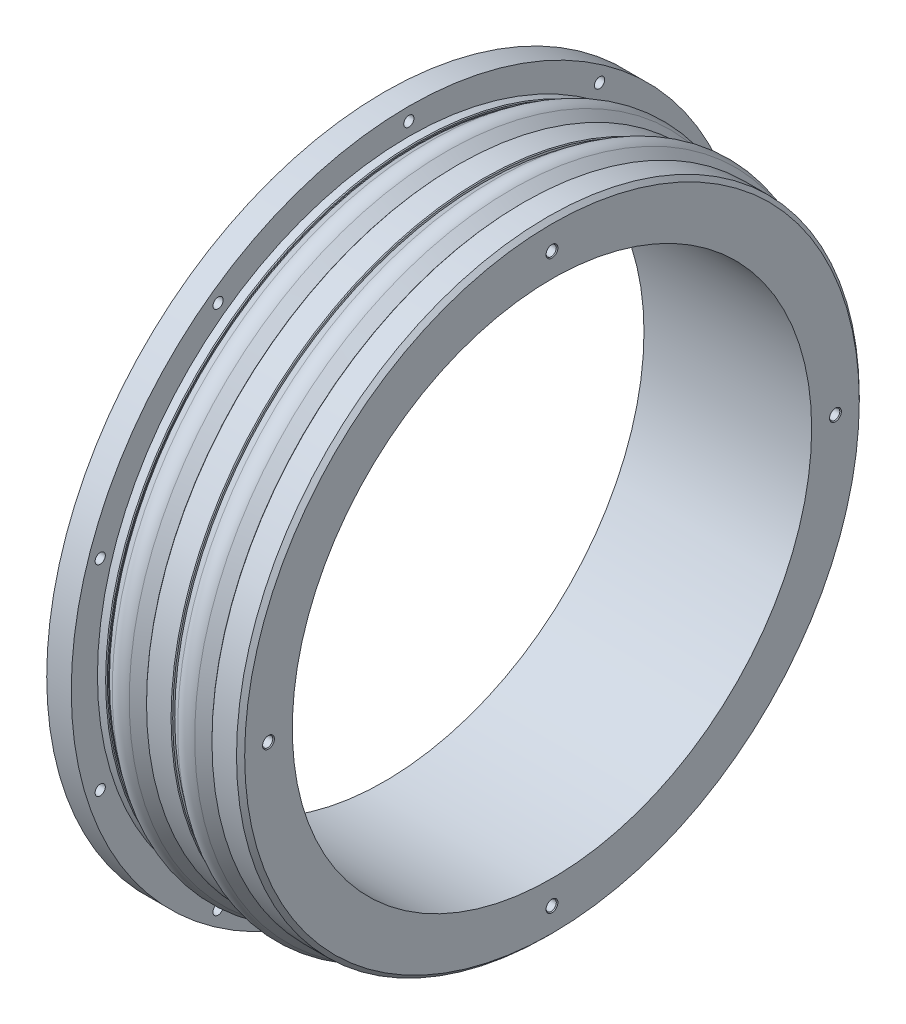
SolidWorks part; units mm, degrees
ref_plane "Front Plane" through (0, 0, 0) normal (0, 0, 1) x (1, 0, 0)
ref_plane "Top Plane" through (0, 0, 0) normal (0, 1, 0) x (1, 0, 0)
ref_plane "Right Plane" through (0, 0, 0) normal (1, 0, 0) x (0, 0, -1)
sketch "Sketch2" plane through (0, 0, 0) normal (0, 1, 0) x (1, 0, 0)
  line L0 (0, 0) -> (0, 63.5) construction
  line L1 (0, 63.5) -> (41, 63.5)
  line L2 (41, 63.5) -> (41, 76.145)
  line L3 (41, 76.145) -> (33.8, 76.145)
  line L4 (33.8, 76.145) -> (33.8, 75.145) construction
  line L5 (33.8, 75.145) -> (24.2, 75.145) construction
  line L6 (24.2, 75.145) -> (24.2, 76.145) construction
  line L7 (6, 76.145) -> (8.2, 76.145)
  line L8 (8.2, 76.145) -> (8.2, 75.145) construction
  line L9 (8.2, 75.145) -> (17.8, 75.145) construction
  line L10 (17.8, 75.145) -> (17.8, 76.145) construction
  line L11 (17.8, 76.145) -> (24.2, 76.145)
  line L12 (6, 76.145) -> (6, 82.55)
  line L13 (6, 82.55) -> (0, 82.55)
  line L14 (0, 82.55) -> (0, 75.871)
  line L15 (0, 75.871) -> (0.75, 75.871)
  line L16 (0.75, 75.871) -> (0.75, 72.771) construction
  line L17 (0.75, 72.771) -> (0, 72.771)
  line L18 (0, 72.771) -> (0, 63.5)
  line L19 (6, 76.395) -> (41, 76.395) construction
  line L20 (6, 76.565) -> (41, 76.565) construction
  line L21 (29, 75.145) -> (29, 75.445) construction
  line L22 (0, 0) -> (-153832.3837, 0) construction
  line L23 (13, 75.145) -> (13, 75.445) construction
  line L24 (0.75, 72.771) -> (0.0099, 73.3162)
  line L25 (0.75, 75.871) -> (0.0099, 75.3258)
  line L26 (8.2, 75.445) -> (10.9167, 77.4574)
  line L27 (15.0833, 77.4574) -> (17.8, 75.445)
  line L28 (26.9167, 77.4574) -> (24.2, 75.445)
  line L29 (31.0833, 77.4574) -> (33.8, 75.445)
  line L30 (8.2, 76.145) -> (8.2, 75.445)
  line L31 (17.8, 75.445) -> (17.8, 76.145)
  line L32 (24.2, 76.145) -> (24.2, 75.445)
  line L33 (33.8, 76.145) -> (33.8, 75.445)
  line L34 (41, 71.145) -> (0.75, 71.145) construction
  arc A0 (10.9167, 77.4574) -> (15.0833, 77.4574) centre (13, 74.645) cw
  arc A1 (26.9167, 77.4574) -> (31.0833, 77.4574) centre (29, 74.645) cw
  arc A2 (0.0099, 73.3162) -> (0.0099, 75.3258) centre (0.75, 74.321) cw
  dimension "D3" = 16
  dimension "D8" = 12
  dimension "D9" = 3.5
  dimension "D17" = 5
  dimension "D18" = 1.248
  dimension "D2" = 152.79
  dimension "D4" = 35
  dimension "D5" = 1
  dimension "D6" = 0.25
  dimension "D7" = 153.13
  dimension "D10" = 165.1
  dimension "D11" = 127
  dimension "D12" = 145.542
  dimension "D13" = 6
  dimension "D14" = 9.6
  dimension "D15" = 3.1
  dimension "D16" = 0.75
  dimension "D19" = 0.3
revolve "Revolve1" add sketch "Sketch2" angle 360 about L22
chamfer "Chamfer1" distance 1 angle 45 1 edges at (41, 0, -76.145)
chamfer "Chamfer2" distance 0.2 angle 45 7 edges at (0, 0, -72.771) (0, 0, -75.871) (8.2, 0, -76.145) (8.2, 0, -75.445) (33.8, 0, -76.145) (24.2, 0, -76.145) (17.8, 0, -76.145)
sketch "Sketch3" plane through (6, 0, 0) normal (1, 0, 0) x (0, 0, -1)
  circle A0 centre (0, 0) radius 79.35 construction
  point P6 (0, 79.35)
  point P7 (46.6408, 64.1955)
  point P21 (75.4663, 24.5205)
  point P33 (75.4663, -24.5205)
  point P34 (46.6408, -64.1955)
  point P35 (0, -79.35)
  point P36 (-46.6408, -64.1955)
  point P37 (-75.4663, -24.5205)
  point P39 (-75.4663, 24.5205)
  point P40 (-46.6408, 64.1955)
  point P41 (0, 0)
  dimension "D2" = 158.7
  dimension "D1" = 10
hole_wizard "Tap Drill for M3x0.5 Tap1" positions "3DSketch1" profile "Sketch4" hole size "M3x0.5" standard "ANSI Metric"
sketch3d "3DSketch1"
  point P0 (6, 79.35, 0)
  point P3 (6, 64.1955, -46.6408)
  point P6 (6, 24.5205, -75.4663)
  point P9 (6, -24.5205, -75.4663)
  point P12 (6, -64.1955, -46.6408)
  point P15 (6, -79.35, 0)
  point P18 (6, -64.1955, 46.6408)
  point P21 (6, -24.5205, 75.4663)
  point P24 (6, 24.5205, 75.4663)
  point P27 (6, 64.1955, 46.6408)
sketch "Sketch4" plane through (6, 79.35, 0) normal (0, 1, 0) x (0, 0, -1)
  line L0 (0, 0) -> (0, 6.498)
  line L1 (0, 6.498) -> (1.25, 6.498)
  line L2 (1.25, 6.498) -> (1.25, 0)
  line L5 (1.25, 0) -> (0, 0)
  line L11 (0, -6.35) -> (0, 107.95) construction
  dimension "Thru Hole Dia." = 2.5
  dimension "Thru Hole Depth" = 6.498
chamfer "Chamfer3" distance 0.2 angle 45 10 edges at (0, 24.5205, 76.7163) (0, 64.1955, 47.8908) (0, 79.35, 1.25) (0, 64.1955, -45.3908) (0, 24.5205, -74.2163) (0, -24.5205, -74.2163) (0, -64.1955, -45.3908) (0, -79.35, 1.25) (0, -64.1955, 47.8908) (0, -24.5205, 76.7163)
sketch "Sketch5" plane through (41, 0, 0) normal (1, 0, 0) x (0, 0, -1)
  line L0 (0, 75.145) -> (0, 63.5) construction
  line L1 (0, -75.145) -> (0, -63.5) construction
  circle A0 centre (0, 0) radius 75.145 construction
  circle A1 centre (0, 0) radius 63.5 construction
  point P7 (0, 69.3225)
  point P11 (69.3225, 0)
  point P12 (0, -69.3225)
  point P13 (-69.3225, 0)
  point P14 (0, 0)
  dimension "D1" = 4
hole_wizard "Tap Drill for M3x0.5 Tap2" positions "3DSketch2" profile "Sketch6" hole size "M3x0.5" standard "ANSI Metric"
sketch3d "3DSketch2"
  point P0 (41, 69.3225, 0)
  point P3 (41, 0, -69.3225)
  point P6 (41, -69.3225, 0)
  point P9 (41, 0, 69.3225)
sketch "Sketch6" plane through (41, 69.3225, 0) normal (0, 1, 0) x (0, 0, -1)
  line L0 (0, 0) -> (0, 4.7511)
  line L1 (0, 4.7511) -> (1.25, 4)
  line L2 (1.25, 4) -> (1.25, 0)
  line L5 (1.25, 0) -> (0, 0)
  line L10 (0, 4.7511) -> (-1.25, 4) construction
  line L11 (0, -6.35) -> (0, 107.95) construction
  dimension "Hole Dia." = 2.5
  dimension "Hole Depth" = 4
  dimension "Drill Angle" = 118
chamfer "Chamfer4" distance 0.2 angle 45 4 edges at (41, 0, 68.0725) (41, -69.3225, -1.25) (41, 0, -70.5725) (41, 69.3225, -1.25)
